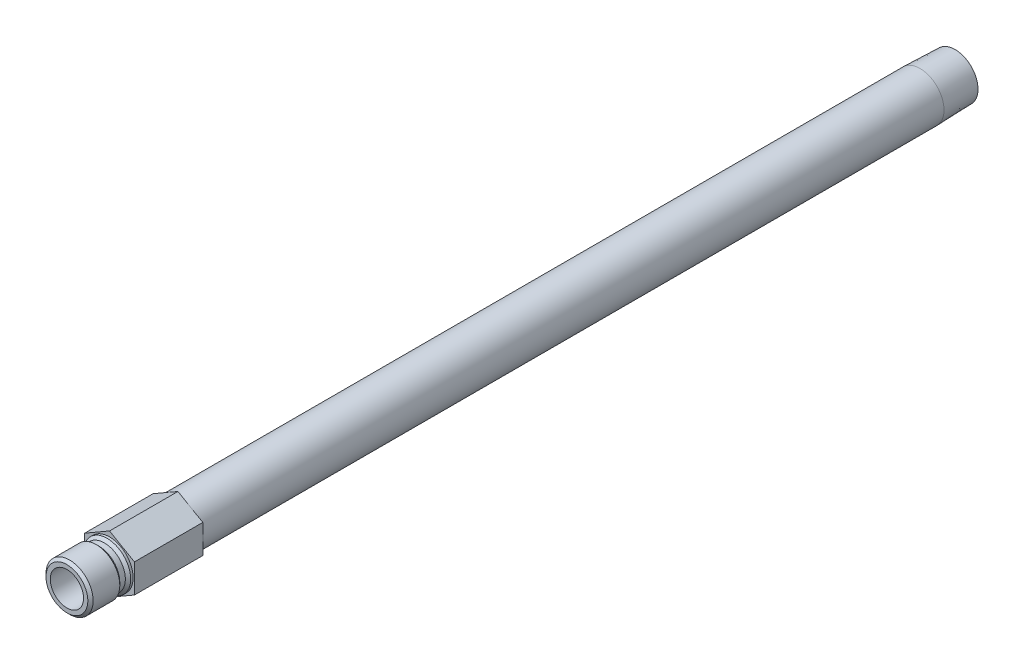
SolidWorks part; units mm, degrees
ref_plane "Front Plane" through (0, 0, 0) normal (0, 0, 1) x (1, 0, 0)
ref_plane "Top Plane" through (0, 0, 0) normal (0, 1, 0) x (1, 0, 0)
ref_plane "Right Plane" through (0, 0, 0) normal (1, 0, 0) x (0, 0, -1)
sketch "Sketch1" plane through (0, 0, 0) normal (1, 0, 0) x (0, 0, -1)
  line L0 (0, 0) -> (-15.367, 0) construction
  line L1 (-12.192, 4.7625) -> (-12.192, 5.9817)
  line L2 (-3.048, 5.9817) -> (-3.048, 0) construction
  line L3 (-11.43, 6.7437) -> (-3.81, 6.7437)
  line L4 (0, 6.858) -> (0, 4.7625) construction
  line L5 (-3.048, 5.9817) -> (-1.4605, 5.9817)
  line L6 (-0.6985, 6.7437) -> (0, 6.7437)
  line L7 (0, 6.7437) -> (0, 6.858)
  line L8 (-3.048, 5.9817) -> (-3.81, 6.7437)
  line L9 (-1.4605, 5.9817) -> (-0.6985, 6.7437)
  line L10 (-12.192, 5.9817) -> (-11.43, 6.7437)
  line L11 (-12.192, 4.7625) -> (0, 4.7625)
  line L12 (0, 6.858) -> (231.775, 6.858)
  line L13 (231.775, 6.858) -> (241.808, 6.5445)
  line L14 (241.808, 6.5445) -> (241.808, 4.6228)
  line L15 (0, 6.7437) -> (19.558, 6.7437) construction
  line L16 (19.558, 6.7437) -> (19.558, 0) construction
  line L17 (19.558, 0) -> (0, 0) construction
  line L19 (0.0743, 4.6228) -> (241.808, 4.6228)
  line L20 (0, 4.7625) -> (0.0743, 4.6228)
  line L21 (0, 4.6272) -> (0, 0) construction
  dimension "D2" = 1.5875
  dimension "D3" = 0.762
  dimension "D4" = 45
  dimension "D5" = 9.144
  dimension "D6" = 45
  dimension "D7" = 1.79
  dimension "D8" = 10.033
  dimension "D9" = 254
  dimension "D10" = 3.175
  dimension "D11" = 9.525
  dimension "D12" = 13.716
  dimension "D13" = 31.75
  dimension "D14" = 13.4874
  dimension "D15" = 9.2456
  dimension "D16" = 19.558
  dimension "D17" = 118
  dimension "D18" = 12.192
revolve "Revolve1" add sketch "Sketch1" angle 360 about L0
sketch "Sketch2" plane through (0, 0, 0) normal (0, 0, 1) x (1, 0, 0)
  line L1 (-7.112, 4.1061) -> (-7.112, -4.1061)
  line L2 (-7.112, -4.1061) -> (0, -8.2122)
  line L3 (0, -8.2122) -> (7.112, -4.1061)
  line L4 (7.112, -4.1061) -> (7.112, 4.1061)
  line L5 (7.112, 4.1061) -> (0, 8.2122)
  line L6 (0, 8.2122) -> (-7.112, 4.1061)
  circle A0 centre (0, 0) radius 7.112 construction
  circle A1 centre (0, 0) radius 4.6228 construction
  circle A2 centre (0, 0) radius 4.6228
  dimension "D1" = 14.224
extrude "Boss-Extrude1" add sketch "Sketch2" against normal up to vertex (19.558 mm away) from vertex at 0
